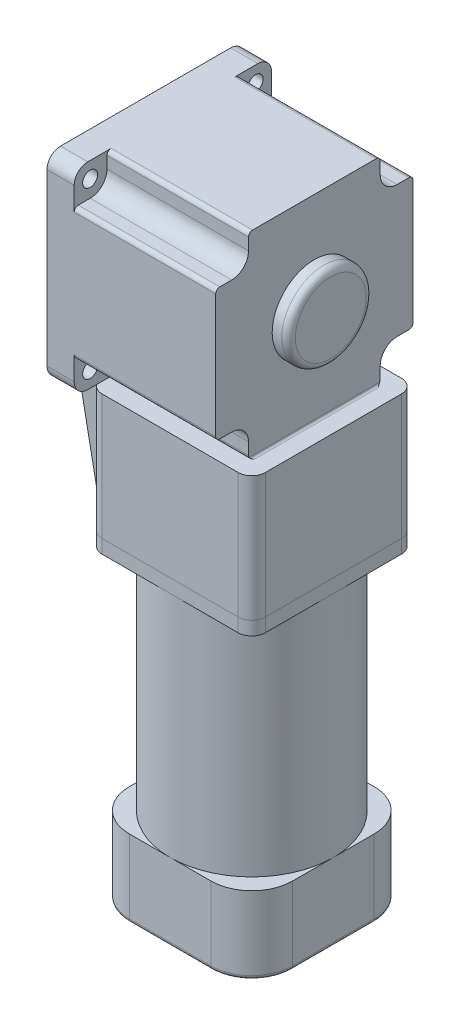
SolidWorks part; units mm, degrees
ref_plane "前视基准面" through (0, 0, 0) normal (0, 0, 1) x (1, 0, 0)
ref_plane "上视基准面" through (0, 0, 0) normal (0, 1, 0) x (1, 0, 0)
ref_plane "右视基准面" through (0, 0, 0) normal (1, 0, 0) x (0, 0, -1)
sketch "草图1" plane through (0, 0, 0) normal (1, 0, 0) x (0, 0, -1)
  line L1 (-62.5, -72.5) -> (62.5, -72.5)
  line L2 (-72.5, -62.5) -> (-72.5, 62.5)
  line L3 (-62.5, 72.5) -> (62.5, 72.5)
  line L4 (72.5, -62.5) -> (72.5, 62.5)
  line L5 (-72.5, -72.5) -> (72.5, 72.5) construction
  line L6 (-72.5, 72.5) -> (72.5, -72.5) construction
  arc A0 (62.5, 72.5) -> (72.5, 62.5) centre (62.5, 62.5) cw
  arc A1 (62.5, -72.5) -> (72.5, -62.5) centre (62.5, -62.5) ccw
  arc A2 (-62.5, -72.5) -> (-72.5, -62.5) centre (-62.5, -62.5) cw
  arc A3 (-72.5, 62.5) -> (-62.5, 72.5) centre (-62.5, 62.5) cw
  point P0 (0, 0)
  dimension "D1" = 10
extrude "凸台-拉伸1" add sketch "草图1" along normal blind 124
sketch "草图2" plane through (124, 0, 0) normal (1, 0, 0) x (0, 0, -1)
  line L0 (-60.8, 48.3958) -> (-69.5, 48.3958)
  line L1 (-72.5, -62.5) -> (-72.5, -45.3958)
  line L3 (-62.5, 72.5) -> (-45.3958, 72.5)
  line L5 (72.5, 62.5) -> (72.5, 45.3958)
  line L6 (-45.3958, -72.5) -> (-62.5, -72.5)
  line L7 (-72.5, 62.5) -> (-72.5, -62.5) construction
  line L8 (45.3958, 72.5) -> (62.5, 72.5)
  line L9 (-69.5, -48.3958) -> (-60.8, -48.3958)
  line L10 (62.5, -72.5) -> (45.3958, -72.5)
  line L11 (-48.3958, -60.8) -> (-48.3958, -69.5)
  line L12 (-62.5, -72.5) -> (62.5, -72.5) construction
  line L13 (72.5, -45.3958) -> (72.5, -62.5)
  line L14 (48.3958, -69.5) -> (48.3958, -60.8)
  line L15 (-72.5, 45.3958) -> (-72.5, 62.5)
  line L16 (60.8, -48.3958) -> (69.5, -48.3958)
  line L17 (72.5, -62.5) -> (72.5, 62.5) construction
  line L19 (69.5, 48.3958) -> (60.8, 48.3958)
  line L21 (48.3958, 60.8) -> (48.3958, 69.5)
  line L22 (62.5, 72.5) -> (-62.5, 72.5) construction
  line L24 (-48.3958, 69.5) -> (-48.3958, 60.8)
  arc A0 (-60.8, 48.3958) -> (-48.3958, 60.8) centre (-60.8, 60.8) ccw
  arc A1 (48.3958, 60.8) -> (60.8, 48.3958) centre (60.8, 60.8) ccw
  arc A2 (60.8, -48.3958) -> (48.3958, -60.8) centre (60.8, -60.8) ccw
  arc A3 (-48.3958, -60.8) -> (-60.8, -48.3958) centre (-60.8, -60.8) ccw
  arc A4 (-45.3958, 72.5) -> (-48.3958, 69.5) centre (-45.3958, 69.5) ccw
  arc A5 (48.3958, 69.5) -> (45.3958, 72.5) centre (45.3958, 69.5) ccw
  arc A6 (72.5, 45.3958) -> (69.5, 48.3958) centre (69.5, 45.3958) ccw
  arc A7 (69.5, -48.3958) -> (72.5, -45.3958) centre (69.5, -45.3958) ccw
  arc A8 (45.3958, -72.5) -> (48.3958, -69.5) centre (45.3958, -69.5) ccw
  arc A9 (-48.3958, -69.5) -> (-45.3958, -72.5) centre (-45.3958, -69.5) ccw
  arc A10 (-72.5, -45.3958) -> (-69.5, -48.3958) centre (-69.5, -45.3958) ccw
  arc A11 (-69.5, 48.3958) -> (-72.5, 45.3958) centre (-69.5, 45.3958) ccw
  arc A12 (-62.5, 72.5) -> (-72.5, 62.5) centre (-62.5, 62.5) ccw
  arc A13 (72.5, 62.5) -> (62.5, 72.5) centre (62.5, 62.5) ccw
  arc A14 (-72.5, -62.5) -> (-62.5, -72.5) centre (-62.5, -62.5) ccw
  arc A15 (62.5, -72.5) -> (72.5, -62.5) centre (62.5, -62.5) ccw
  point P0 (0, 0)
  point P8 (-48.3958, 72.5)
  point P35 (48.3958, 72.5)
  point P38 (72.5, 48.3958)
  point P41 (72.5, -48.3958)
  point P44 (48.3958, -72.5)
  point P47 (-48.3958, -72.5)
  point P50 (-72.5, -48.3958)
  point P53 (-72.5, 48.3958)
  dimension "D1" = 3
extrude "切除-拉伸1" cut sketch "草图2" against normal blind 104
sketch "草图3" plane through (0, 0, 0) normal (-1, 0, 0) x (0, 0, 1)
  circle A0 centre (-60.8, 60.8) radius 5.5
  circle A1 centre (60.8, 60.8) radius 5.5
  circle A2 centre (60.8, -60.8) radius 5.5
  circle A3 centre (-60.8, -60.8) radius 5.5
  point P0 (0, 0)
extrude "切除-拉伸2" cut sketch "草图3" against normal blind 20
sketch "草图4" plane through (0, 0, 0) normal (-1, 0, 0) x (0, 0, 1)
  line L9 (-47.2986, 61.204) -> (-66.9163, 3.204)
  line L10 (-37.8258, 68) -> (37.8258, 68)
  line L11 (47.2986, 61.204) -> (66.9163, 3.204)
  line L13 (-47.2986, -61.204) -> (-66.9163, -3.204)
  line L14 (-37.8258, -68) -> (37.8258, -68)
  line L15 (47.2986, -61.204) -> (66.9163, -3.204)
  arc A0 (37.8258, 68) -> (47.2986, 61.204) centre (37.8258, 58) cw
  arc A1 (66.9163, -3.204) -> (66.9163, 3.204) centre (57.4435, 0) ccw
  arc A2 (37.8258, -68) -> (47.2986, -61.204) centre (37.8258, -58) ccw
  arc A3 (-47.2986, -61.204) -> (-37.8258, -68) centre (-37.8258, -58) ccw
  arc A4 (-66.9163, -3.204) -> (-66.9163, 3.204) centre (-57.4435, 0) cw
  arc A5 (-37.8258, 68) -> (-47.2986, 61.204) centre (-37.8258, 58) ccw
  dimension "D1" = 10
extrude "切除-拉伸3" cut sketch "草图4" against normal blind 1
fillet "圆角2" radius 1 12 edges at (1, 66.1253, -43.655) (1, 68, 0) (1, 66.1253, 43.655) (1, 32.204, 57.1075) (1, 0, 67.4435) (1, -32.204, 57.1075) (1, -66.1253, 43.655) (1, -68, 0) (1, -66.1253, -43.655) (1, -32.204, -57.1075) (1, 0, -67.4435) (1, 32.204, -57.1075)
sketch "草图5" plane through (1, 0, 0) normal (-1, 0, 0) x (0, 0, 1)
  circle A0 centre (0, 0) radius 27.5
extrude "凸台-拉伸2" add sketch "草图5" along normal blind 4
fillet "圆角3" radius 1 1 edges at (-3, 0, 27.5)
ref_plane "基准面1" through (0, 0, 15) normal (0, 0, 1) x (1, 0, 0)
sketch "草图11" plane through (0, -72.5, 0) normal (0, -1, 0) x (1, 0, 0)
  line L3 (28, -60) -> (128, -60)
  line L4 (18, -50) -> (18, 50)
  line L5 (28, 60) -> (128, 60)
  line L6 (138, -50) -> (138, 50)
  line L7 (18, -60) -> (138, 60) construction
  line L8 (18, 60) -> (138, -60) construction
  arc A0 (28, -60) -> (18, -50) centre (28, -50) cw
  arc A1 (128, -60) -> (138, -50) centre (128, -50) ccw
  arc A2 (128, 60) -> (138, 50) centre (128, 50) cw
  arc A3 (18, 50) -> (28, 60) centre (28, 50) cw
  point P3 (78, 0)
  dimension "D1" = 10
extrude "凸台-拉伸7" add sketch "草图11" along normal blind 92
fillet "圆角8" radius 1.5 1 edges at (124, -72.5, 0)
ref_plane "基准面2" through (0, 0, 50) normal (0, 0, 1) x (1, 0, 0)
ref_plane "基准面3" through (0, 0, -50) normal (0, 0, 1) x (1, 0, 0)
sketch "草图12" plane through (0, 0, 50) normal (0, 0, 1) x (1, 0, 0)
  line L0 (18, -72.5) -> (0, -72.5)
  line L1 (0, -72.5) -> (18, -164.5)
  line L2 (18, -164.5) -> (18, -72.5)
extrude "凸台-拉伸8" add sketch "草图12" against normal blind 15
sketch "草图14" plane through (0, 0, -50) normal (0, 0, 1) x (1, 0, 0)
  line L0 (18, -72.5) -> (0, -72.5)
  line L1 (0, -72.5) -> (18, -164.5)
  line L2 (18, -164.5) -> (18, -72.5)
extrude "凸台-拉伸9" add sketch "草图14" along normal blind 15
sketch "草图15" plane through (0, -164.5, 0) normal (0, -1, 0) x (1, 0, 0)
  line L4 (28, -60) -> (128, -60)
  line L5 (18, -50) -> (18, 50)
  line L6 (28, 60) -> (128, 60)
  line L7 (138, -50) -> (138, 50)
  line L8 (18, -60) -> (138, 60) construction
  line L9 (18, 60) -> (138, -60) construction
  arc A0 (128, -60) -> (138, -50) centre (128, -50) ccw
  arc A1 (28, -60) -> (18, -50) centre (28, -50) cw
  arc A2 (18, 50) -> (28, 60) centre (28, 50) cw
  arc A3 (128, 60) -> (138, 50) centre (128, 50) cw
  point P6 (78, 0)
  dimension "D1" = 10
extrude "凸台-拉伸10" add sketch "草图15" along normal blind 10 separate body
sketch "草图16" plane through (0, -174.5, 0) normal (0, -1, 0) x (1, 0, 0)
  circle A0 centre (78, 0) radius 60
extrude "凸台-拉伸11" add sketch "草图16" along normal blind 168 separate body
sketch "草图17" plane through (0, -342.5, 0) normal (0, -1, 0) x (1, 0, 0)
  line L1 (48, -60) -> (108, -60)
  line L2 (18, -30) -> (18, 30)
  line L3 (48, 60) -> (108, 60)
  line L4 (138, -30) -> (138, 30)
  line L5 (18, -60) -> (138, 60) construction
  line L6 (18, 60) -> (138, -60) construction
  arc A0 (108, 60) -> (138, 30) centre (108, 30) cw
  arc A1 (18, 30) -> (48, 60) centre (48, 30) cw
  arc A2 (108, -60) -> (138, -30) centre (108, -30) ccw
  arc A3 (48, -60) -> (18, -30) centre (48, -30) cw
  point P0 (78, 0)
  dimension "D1" = 30
  dimension "D2" = 30
extrude "凸台-拉伸13" add sketch "草图17" along normal blind 57
fillet "圆角9" radius 3 8 edges at (138, -399.5, 0) (129.2132, -399.5, -51.2132) (78, -399.5, -60) (26.7868, -399.5, -51.2132) (18, -399.5, 0) (26.7868, -399.5, 51.2132) (78, -399.5, 60) (129.2132, -399.5, 51.2132)
sketch "草图19" plane through (124, 0, 0) normal (1, 0, 0) x (0, 0, -1)
  circle A0 centre (0, 0) radius 31
extrude "凸台-拉伸14" add sketch "草图19" along normal blind 12
fillet "圆角10" radius 5 1 edges at (136, 0, -31)
sketch "草图22" plane through (-3, 0, 0) normal (-1, 0, 0) x (0, 0, 1)
  line L2 (18.3, -4) -> (14.4568, -4)
  line L4 (14.4568, 4) -> (18.3, 4)
  line L5 (18.3, 4) -> (18.3, -4)
  arc A0 (14.4568, 4) -> (14.4568, -4) centre (0, 0) ccw
extrude "切除-拉伸4" cut sketch "草图22" against normal blind 130
